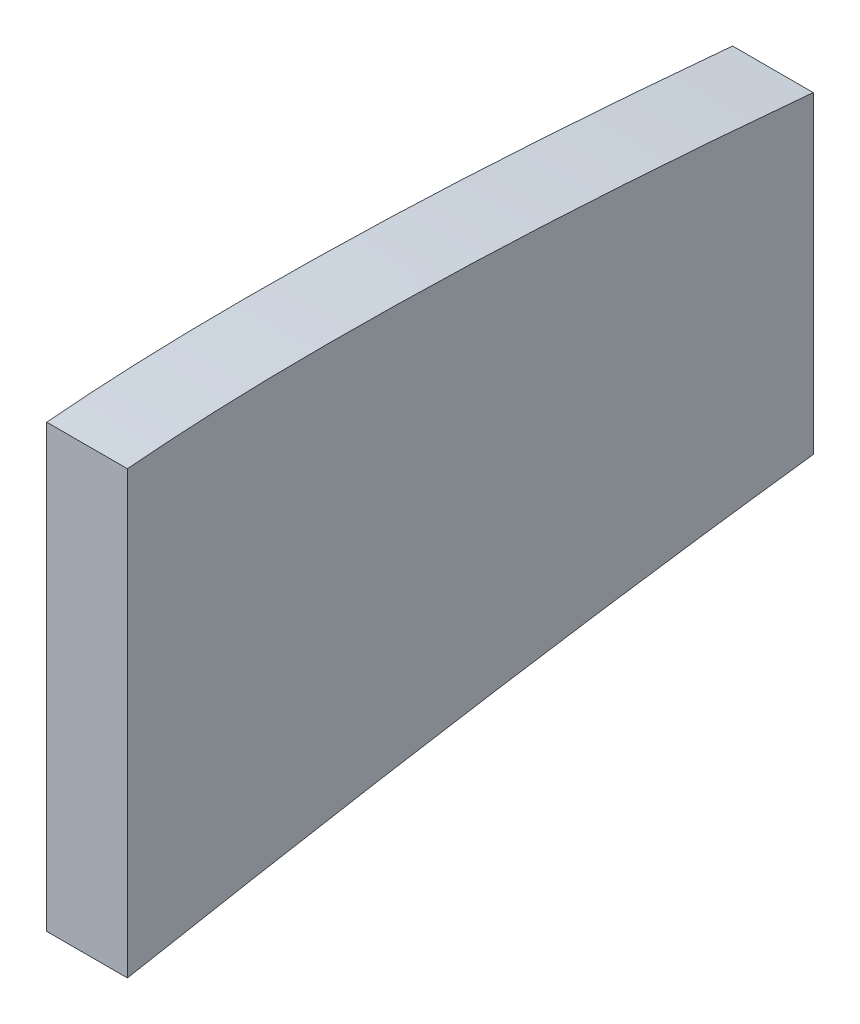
SolidWorks part; units mm, degrees
ref_plane "Front Plane" through (0, 0, 0) normal (0, 0, 1) x (1, 0, 0)
ref_plane "Top Plane" through (0, 0, 0) normal (0, 1, 0) x (1, 0, 0)
ref_plane "Right Plane" through (0, 0, 0) normal (1, 0, 0) x (0, 0, -1)
curve "Curve1"
sketch "Sketch1" plane through (0, 0, 0) normal (1, 0, 0) x (0, 0, -1)
  line L1 (0, 0) -> (0, 95.7684) construction
  line L2 (36.5125, 19.4825) -> (36.5125, 2.1283)
  line L3 (63.5, 18.8083) -> (63.5, 6.4745)
  spline S0 degree 3 poles (63.5, 18.8083) (62.6475, 18.8859) (60.0791, 19.1105) (55.8474, 19.4276) (50.8648, 19.6931) (46.0697, 19.8087) (41.4867, 19.7981) (38.3249, 19.6366) (36.6955, 19.4987) (36.5125, 19.4825) knots 1.279493 1.279493 1.279493 1.279493 1.287887 1.304773 1.321101 1.336806 1.3518 1.366031 1.367832 1.367832 1.367832 1.367832
  spline S1 degree 3 poles (36.5125, 2.1283) (37.8143, 2.3724) (41.0984, 2.9823) (46.473, 3.938) (52.7259, 4.9663) (58.4366, 5.8126) (62.0594, 6.2928) (63.5, 6.4745) knots 0.636069 0.636069 0.636069 0.636069 0.649056 0.668822 0.689595 0.71119 0.725427 0.725427 0.725427 0.725427
  dimension "D2" = 36.5125
  dimension "D3" = 63.5
extrude "Boss-Extrude1" add sketch "Sketch1" along normal blind 3.175
